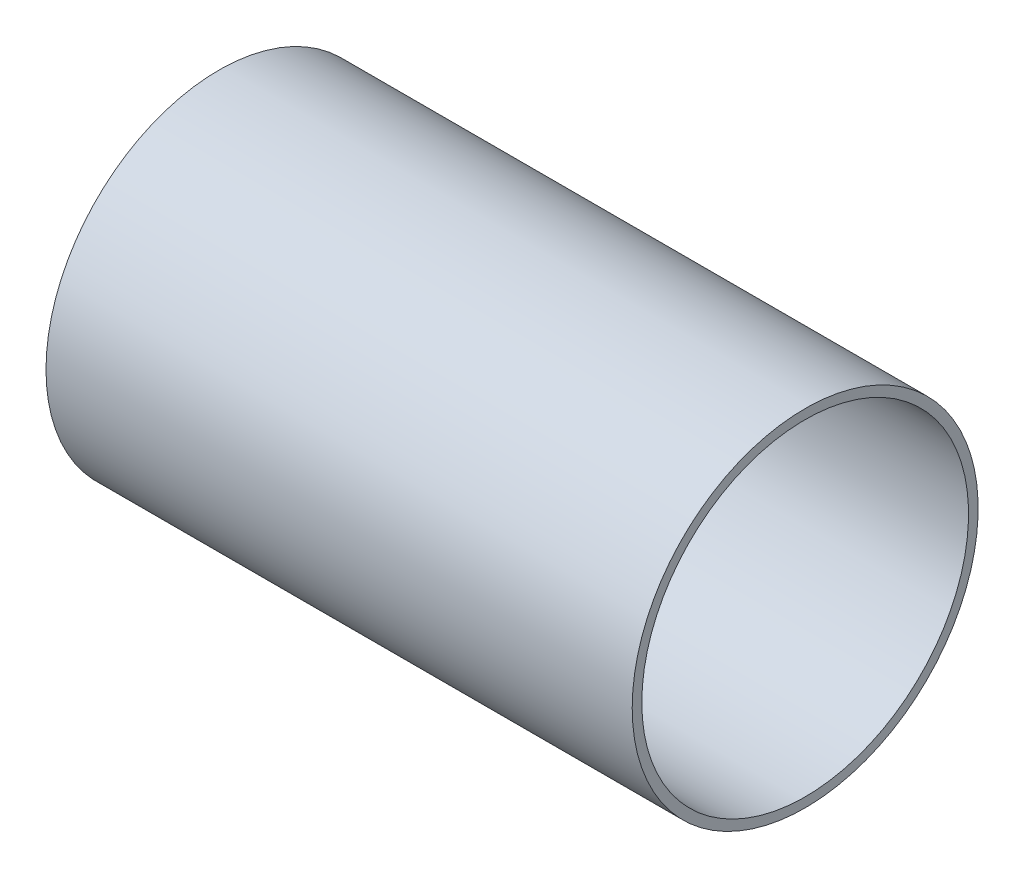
SolidWorks part; units mm, degrees
ref_plane "Front Plane" through (0, 0, 0) normal (0, 0, 1) x (1, 0, 0)
ref_plane "Top Plane" through (0, 0, 0) normal (0, 1, 0) x (1, 0, 0)
ref_plane "Right Plane" through (0, 0, 0) normal (1, 0, 0) x (0, 0, -1)
sketch "Sketch2" plane through (0, 0, 0) normal (-1, 0, 0) x (0, 1, 0)
  circle A0 centre (0, 0) radius 114.3
  circle A1 centre (0, 0) radius 107.95
  dimension "D1" = 228.6
  dimension "D2" = 6.35
extrude "Extrude2" add sketch "Sketch2" along normal blind 387.35
chamfer "Chamfer1" [suppressed] distance 3.175 angle 45
